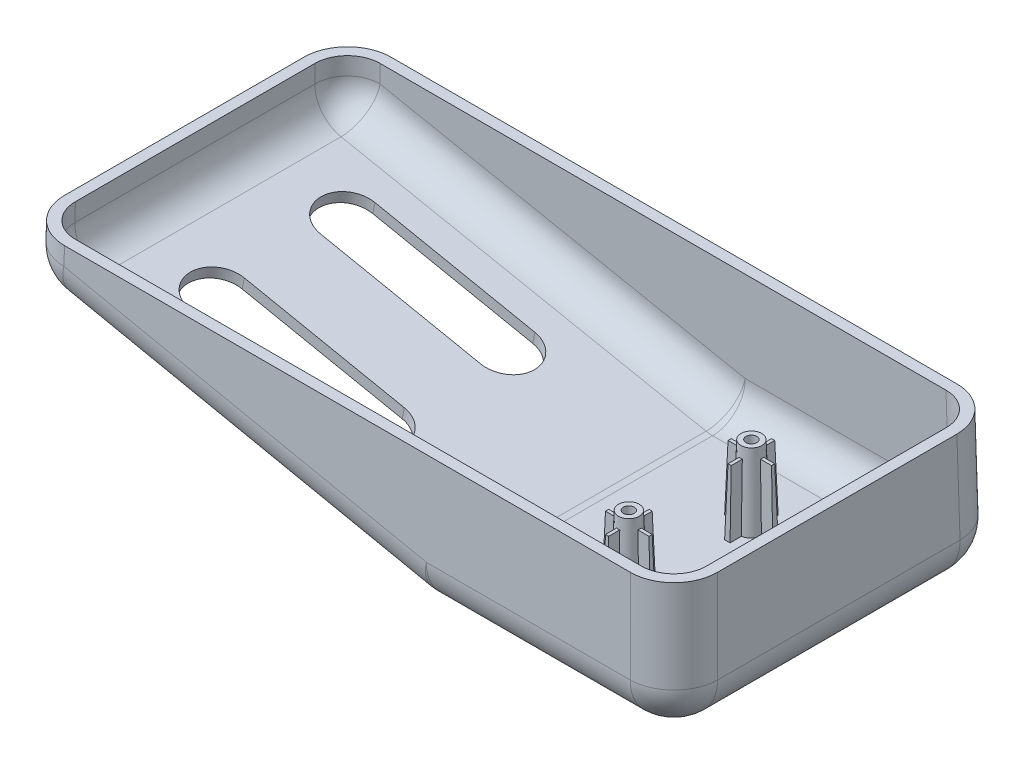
SolidWorks part; units mm, degrees
ref_plane "Front Plane" through (0, 0, 0) normal (0, 0, 1) x (1, 0, 0)
ref_plane "Top Plane" through (0, 0, 0) normal (0, 1, 0) x (1, 0, 0)
ref_plane "Right Plane" through (0, 0, 0) normal (1, 0, 0) x (0, 0, -1)
sketch "Sketch1" plane through (0, 0, 0) normal (0, 0, 1) x (1, 0, 0)
  line L0 (-60, 0) -> (60, 0)
  line L1 (60, 0) -> (60, -25)
  line L2 (60, -25) -> (14, -25)
  line L3 (14, -25) -> (-60, -10)
  line L4 (-60, -10) -> (-60, 0)
  point P6 (0, 0)
  dimension "D1" = 120
  dimension "D2" = 25
  dimension "D3" = 10
  dimension "D4" = 46
extrude "Boss-Extrude1" add sketch "Sketch1" along normal mid plane 60
draft "Draft1" type of draft neutral plane draft angle 1 faces to draft 4 parameters "D1"=1
fillet "Fillet1" radius 8 11 edges at (-23.087, -17.4824, 30.3052) (-60.1739, -9.9647, 0) (-23.087, -17.4824, -30.3052) (14, -25, 0) (60.4364, -25, 0) (37.2182, -25, 30.4364) (37.2182, -25, -30.4364) (60.2182, -12.5, 30.2182) (-60.087, -4.9824, 30.087) (-60.087, -4.9824, -30.087) (60.2182, -12.5, -30.2182)
shell "Shell1" thickness 2
sketch "Sketch2" plane through (-4.315, -21.2875, 0) normal (-0.1987, -0.9801, 0) x (0.9801, -0.1987, 0)
  line L0 (-38.8041, 12) -> (-8.8041, 12) construction
  line L1 (-38.8041, 17) -> (-8.8041, 17)
  line L2 (-38.8041, 7) -> (-8.8041, 7)
  line L3 (-38.8041, -12) -> (-8.8041, -12) construction
  line L4 (-38.8041, -7) -> (-8.8041, -7)
  line L5 (-38.8041, -17) -> (-8.8041, -17)
  line L6 (-58.8041, 22.0012) -> (-58.8041, -22.0012) construction
  line L8 (50.9647, -30) -> (-50.9647, -30) construction
  arc A0 (-38.8041, 17) -> (-38.8041, 7) centre (-38.8041, 12) ccw
  arc A1 (-8.8041, 7) -> (-8.8041, 17) centre (-8.8041, 12) ccw
  arc A2 (-38.8041, -7) -> (-38.8041, -17) centre (-38.8041, -12) ccw
  arc A3 (-8.8041, -17) -> (-8.8041, -7) centre (-8.8041, -12) ccw
  point P2 (-23.8041, 12)
  point P7 (-23.8041, -12)
  dimension "D3" = 10
  dimension "D1" = 30
  dimension "D2" = 20
  dimension "D4" = 18
  dimension "D5" = 24
extrude "Cut-Extrude1" cut sketch "Sketch2" against normal up to next
sketch3d "3DSketch1"
  line L0 (60.2943, -16.8604, 22.2955) -> (60.2943, -16.8604, -22.2955) construction
  line L1 (52.2955, -16.8604, -30.2943) -> (14.8026, -16.8604, -30.2943) construction
  point P0 (32.9757, -23, -11.26)
  dimension "D1" = 28
  dimension "D2" = 20
other "Mounting Boss1" parameters "BossDiam"=4.8, "BossHeight"=14, "FinHeight"=12, "FinLength"=4, "FinWidth"=1, "InsDiam"=2, "InsHeight"=5, "BossDraft"=2, "FinDraft"=1, "InsDraft"=1
mirror "Mirror1" about plane through (0, 0, 0) normal (0, 0, 1) of "Mounting Boss1"
